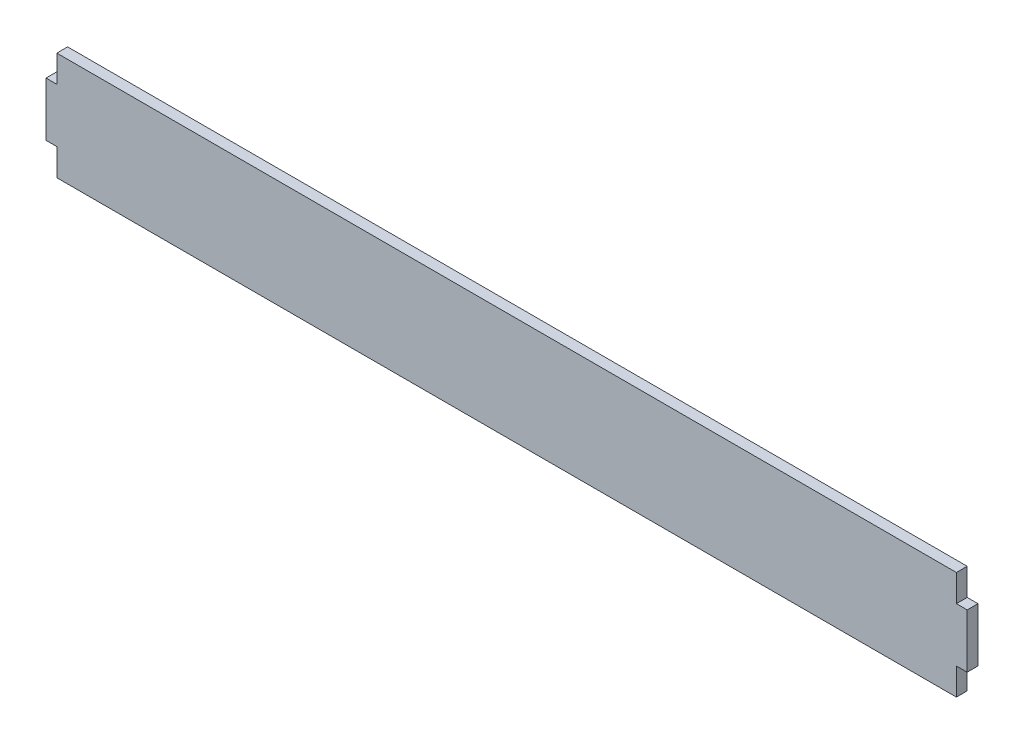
SolidWorks part; units mm, degrees
ref_plane "Alzado" through (0, 0, 0) normal (0, 0, 1) x (1, 0, 0)
ref_plane "Planta" through (0, 0, 0) normal (0, 1, 0) x (1, 0, 0)
ref_plane "Vista lateral" through (0, 0, 0) normal (1, 0, 0) x (0, 0, -1)
sketch "Croquis1" plane through (0, 0, 0) normal (0, 0, 1) x (1, 0, 0)
  line L0 (500, 30) -> (512, 30)
  line L1 (-500, -60) -> (500, -60)
  line L2 (-500, -60) -> (-500, -30)
  line L3 (-500, 60) -> (500, 60)
  line L4 (500, -60) -> (500, -30)
  line L5 (0, 60) -> (0, -60) construction
  line L6 (-512, 0) -> (512, 0) construction
  line L7 (512, 30) -> (512, -30)
  line L8 (512, -30) -> (500, -30)
  line L9 (500, 30) -> (500, 60)
  line L10 (-500, 30) -> (-512, 30)
  line L11 (-512, 30) -> (-512, -30)
  line L12 (-512, -30) -> (-500, -30)
  line L13 (-500, 30) -> (-500, 60)
  point P0 (0, 0)
  point P10 (0, 0)
  point P13 (0, 0)
extrude "Saliente-Extruir1" add sketch "Croquis1" along normal blind 12
equation "\"Material\"= 12"
equation "\"D5@Croquis1\"=\"Material\""
equation "\"D6@Croquis1\"=\"Material\""
equation "\"LargoMesa\"=1000"
equation "\"D7@Croquis1\"=\"LargoMesa\""
